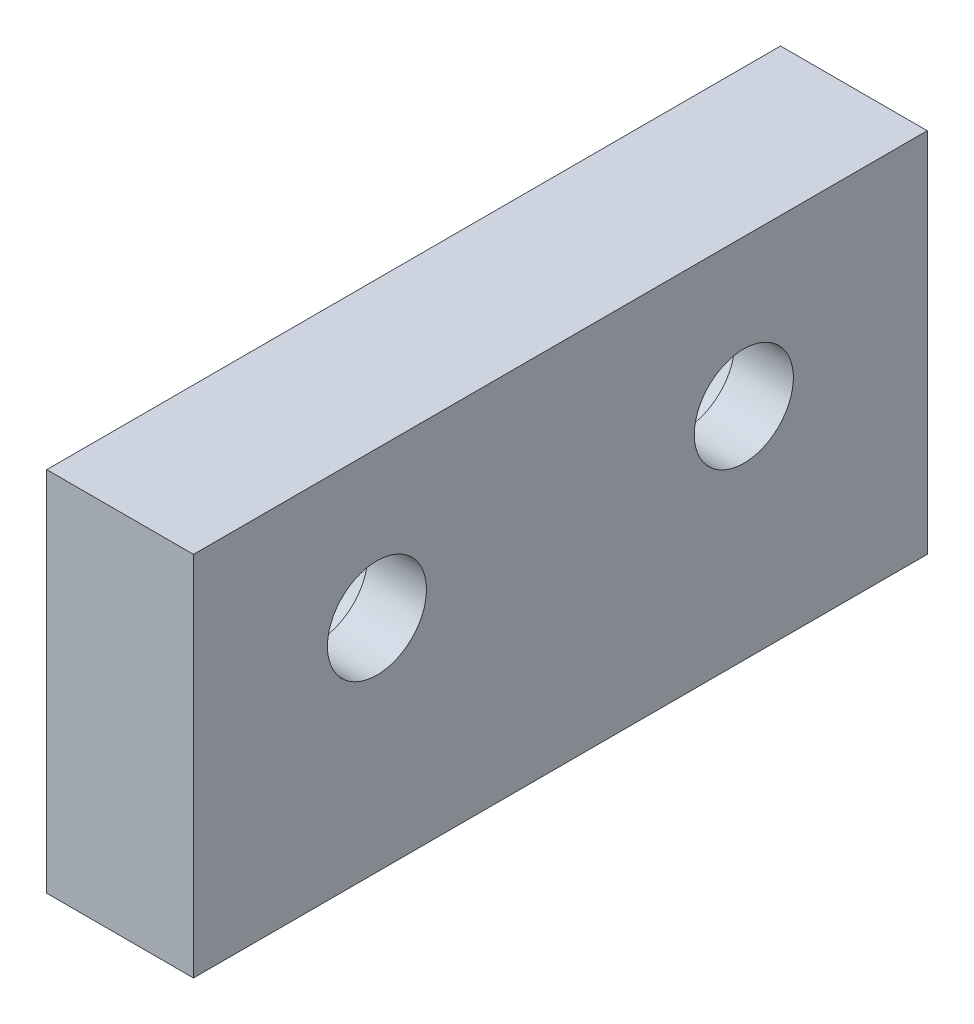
SolidWorks part; units mm, degrees
ref_plane "Plan de face" through (0, 0, 0) normal (0, 0, 1) x (1, 0, 0)
ref_plane "Plan de dessus" through (0, 0, 0) normal (0, 1, 0) x (1, 0, 0)
ref_plane "Plan de droite" through (0, 0, 0) normal (1, 0, 0) x (0, 0, -1)
sketch "Esquisse1" plane through (0, 0, 0) normal (0, 0, 1) x (1, 0, 0)
  line L1 (-20, 20) -> (0, 20)
  line L2 (-20, 20) -> (-20, -30)
  line L3 (-20, -30) -> (0, -30)
  line L4 (0, 20) -> (0, -30)
  dimension "D1" = 20
  dimension "D2" = 50
  dimension "D3" = 20
extrude "Boss.-Extru.1" add sketch "Esquisse1" along normal blind 75 and the other way blind 25
hole_wizard "Chambrage pour vis à tête hexagonale M121" positions "Esquisse3" profile "Esquisse2" counterbore size "M12" standard "ISO"
sketch "Esquisse3" plane through (-20, 0, 0) normal (-1, 0, 0) x (0, 0, 1)
  point P0 (0, 0)
  point P1 (50, 0)
  dimension "D2" = 50
sketch "Esquisse2" plane through (-20, 0, 0) normal (0, 1, 0) x (0, 0, 1)
  line L0 (0, 0) -> (0, 20)
  line L1 (0, 20) -> (6.75, 20)
  line L3 (6.75, 20) -> (6.75, 12)
  line L4 (6.75, 12) -> (10, 12)
  line L5 (10, 12) -> (10, 0)
  line L7 (10, 0) -> (0, 0)
  line L11 (0, -6.35) -> (0, 107.95) construction
  dimension "Diamètre du perçage jusqu'au prochain" = 13.5
  dimension "Profondeur du perçage jusqu'au prochain" = 20
  dimension "Diamètre du chambrage" = 20
  dimension "Profondeur du chambrage" = 12
